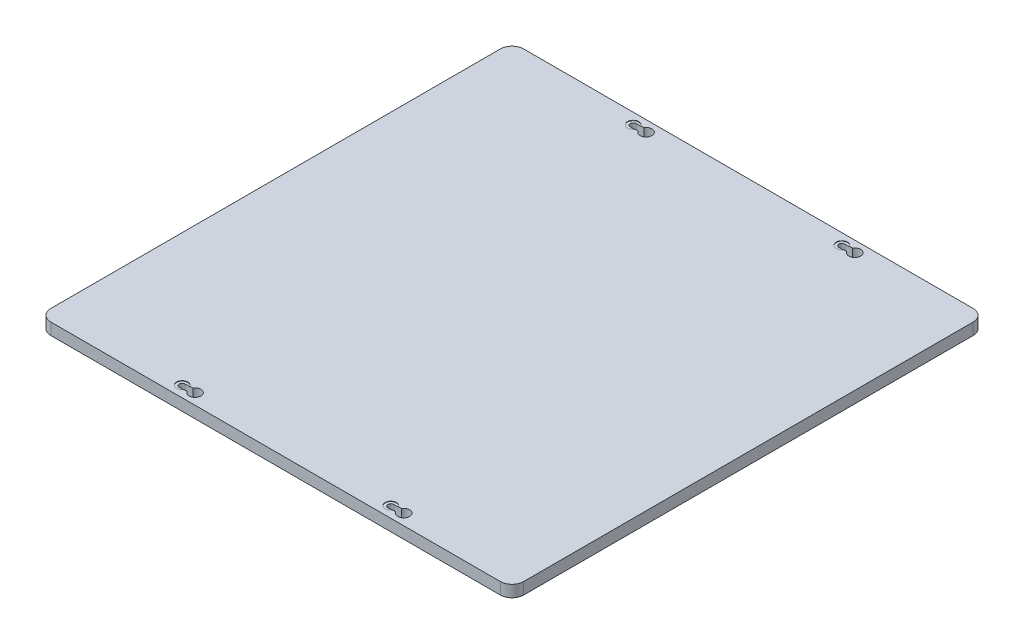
SolidWorks part; units mm, degrees
ref_plane "Front" through (0, 0, 0) normal (0, 0, 1) x (1, 0, 0)
ref_plane "Top" through (0, 0, 0) normal (0, 1, 0) x (1, 0, 0)
ref_plane "Right" through (0, 0, 0) normal (1, 0, 0) x (0, 0, -1)
ref_plane "Plane1" through (0, 3, 0) normal (0, 1, 0) x (1, 0, 0)
sketch "Sketch1" plane through (0, 3, 0) normal (0, 1, 0) x (1, 0, 0)
  line L0 (-115, -121) -> (115, -121)
  line L1 (121, -115) -> (121, 115)
  line L2 (115, 121) -> (-115, 121)
  line L3 (-121, 115) -> (-121, -115)
  arc A0 (115, -121) -> (121, -115) centre (115, -115) ccw
  arc A1 (121, 115) -> (115, 121) centre (115, 115) ccw
  arc A2 (-115, 121) -> (-121, 115) centre (-115, 115) ccw
  arc A3 (-121, -115) -> (-115, -121) centre (-115, -115) ccw
extrude "Boss-Extrude1" add sketch "Sketch1" against normal blind 6
sketch "Sketch2" plane through (0, 3, 0) normal (0, 1, 0) x (-1, 0, 0)
  line L0 (-57.4019, -116.9) -> (-53.4, -116.9)
  line L1 (-53.4, -113.9) -> (-57.4019, -113.9)
  arc A0 (-57.4019, -113.9) -> (-57.4019, -116.9) centre (-60, -115.4) cw
  arc A1 (-53.4, -116.9) -> (-53.4, -113.9) centre (-53.4, -115.4) ccw
extrude "Cut-Extrude1" cut sketch "Sketch2" against normal through all
sketch "Sketch3" plane through (0, 3, 0) normal (0, 1, 0) x (-1, 0, 0)
  line L0 (49.3981, -116.9) -> (53.4, -116.9)
  line L1 (53.4, -113.9) -> (49.3981, -113.9)
  arc A0 (49.3981, -113.9) -> (49.3981, -116.9) centre (46.8, -115.4) cw
  arc A1 (53.4, -116.9) -> (53.4, -113.9) centre (53.4, -115.4) ccw
extrude "Cut-Extrude2" cut sketch "Sketch3" against normal through all
sketch "Sketch4" plane through (0, 3, 0) normal (0, 1, 0) x (-1, 0, 0)
  line L0 (-57.4019, 113.9) -> (-53.4, 113.9)
  line L1 (-53.4, 116.9) -> (-57.4019, 116.9)
  arc A0 (-57.4019, 116.9) -> (-57.4019, 113.9) centre (-60, 115.4) cw
  arc A1 (-53.4, 113.9) -> (-53.4, 116.9) centre (-53.4, 115.4) ccw
extrude "Cut-Extrude3" cut sketch "Sketch4" against normal through all
sketch "Sketch5" plane through (0, -3, 0) normal (0, -1, 0) x (1, 0, 0)
  line L0 (-53.4, 113.9) -> (-49.3981, 113.9)
  line L1 (-49.3981, 116.9) -> (-53.4, 116.9)
  arc A0 (-53.4, 116.9) -> (-53.4, 113.9) centre (-53.4, 115.4) ccw
  arc A1 (-49.3981, 113.9) -> (-49.3981, 116.9) centre (-46.8, 115.4) cw
extrude "Cut-Extrude4" cut sketch "Sketch5" against normal through all
ref_plane "Plane2" through (0, 0, 115.4) normal (0, 0, 1) x (1, 0, 0)
sketch "Sketch6" plane through (0, 0, 115.4) normal (0, 0, 1) x (1, 0, 0)
  line L0 (-43.8, 3) -> (-46.8, 3)
  line L1 (-46.8, 3) -> (-46.8, -3)
  line L2 (-46.8, -3) -> (-43.8, -3)
  line L3 (-43.8, -3) -> (-43.8, 3)
  line L4 (-46.8, 3) -> (-46.8, -3) construction
revolve "Cut-Revolve1" cut sketch "Sketch6" angle 360 about L4
ref_plane "Plane3" through (0, 0, 115.4) normal (0, 0, -1) x (-1, 0, 0)
sketch "Sketch7" plane through (0, 0, 115.4) normal (0, 0, -1) x (-1, 0, 0)
  line L0 (50.55, 2.8) -> (53.4, 2.8)
  line L1 (53.4, 2.8) -> (53.4, 3)
  line L2 (53.4, 3) -> (50.55, 3)
  line L3 (50.55, 3) -> (50.55, 2.8)
  line L4 (53.4, 2.8) -> (53.4, 3) construction
revolve "Cut-Revolve2" cut sketch "Sketch7" angle 360 about L4
sketch "Sketch8" plane through (0, 0, 115.4) normal (0, 0, 1) x (1, 0, 0)
  line L0 (63, 3) -> (60, 3)
  line L1 (60, 3) -> (60, -3)
  line L2 (60, -3) -> (63, -3)
  line L3 (63, -3) -> (63, 3)
  line L4 (60, 3) -> (60, -3) construction
revolve "Cut-Revolve3" cut sketch "Sketch8" angle 360 about L4
sketch "Sketch9" plane through (0, 0, 115.4) normal (0, 0, -1) x (-1, 0, 0)
  line L0 (-56.25, 2.8) -> (-53.4, 2.8)
  line L1 (-53.4, 2.8) -> (-53.4, 3)
  line L2 (-53.4, 3) -> (-56.25, 3)
  line L3 (-56.25, 3) -> (-56.25, 2.8)
  line L4 (-53.4, 2.8) -> (-53.4, 3) construction
revolve "Cut-Revolve4" cut sketch "Sketch9" angle 360 about L4
ref_plane "Plane4" through (0, 0, -115.4) normal (0, 0, 1) x (1, 0, 0)
sketch "Sketch10" plane through (0, 0, -115.4) normal (0, 0, 1) x (1, 0, 0)
  line L0 (-43.8, 3) -> (-46.8, 3)
  line L1 (-46.8, 3) -> (-46.8, -3)
  line L2 (-46.8, -3) -> (-43.8, -3)
  line L3 (-43.8, -3) -> (-43.8, 3)
  line L4 (-46.8, 3) -> (-46.8, -3) construction
revolve "Cut-Revolve5" cut sketch "Sketch10" angle 360 about L4
ref_plane "Plane5" through (0, 0, -115.4) normal (0, 0, -1) x (-1, 0, 0)
sketch "Sketch11" plane through (0, 0, -115.4) normal (0, 0, -1) x (-1, 0, 0)
  line L0 (50.55, 2.8) -> (53.4, 2.8)
  line L1 (53.4, 2.8) -> (53.4, 3)
  line L2 (53.4, 3) -> (50.55, 3)
  line L3 (50.55, 3) -> (50.55, 2.8)
  line L4 (53.4, 2.8) -> (53.4, 3) construction
revolve "Cut-Revolve6" cut sketch "Sketch11" angle 360 about L4
sketch "Sketch12" plane through (0, 0, -115.4) normal (0, 0, 1) x (1, 0, 0)
  line L0 (63, 3) -> (60, 3)
  line L1 (60, 3) -> (60, -3)
  line L2 (60, -3) -> (63, -3)
  line L3 (63, -3) -> (63, 3)
  line L4 (60, 3) -> (60, -3) construction
revolve "Cut-Revolve7" cut sketch "Sketch12" angle 360 about L4
sketch "Sketch13" plane through (0, 0, -115.4) normal (0, 0, -1) x (-1, 0, 0)
  line L0 (-56.25, 2.8) -> (-53.4, 2.8)
  line L1 (-53.4, 2.8) -> (-53.4, 3)
  line L2 (-53.4, 3) -> (-56.25, 3)
  line L3 (-56.25, 3) -> (-56.25, 2.8)
  line L4 (-53.4, 2.8) -> (-53.4, 3) construction
revolve "Cut-Revolve8" cut sketch "Sketch13" angle 360 about L4
